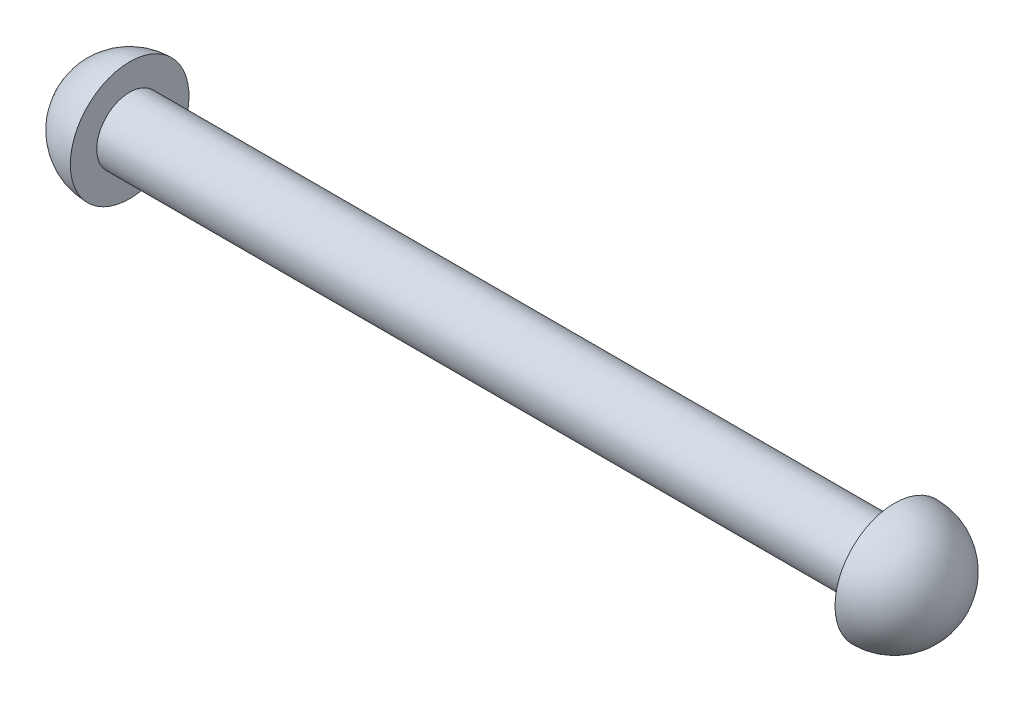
SolidWorks part; units mm, degrees
ref_plane "Front Plane" through (0, 0, 0) normal (0, 0, 1) x (1, 0, 0)
ref_plane "Top Plane" through (0, 0, 0) normal (0, 1, 0) x (1, 0, 0)
ref_plane "Right Plane" through (0, 0, 0) normal (1, 0, 0) x (0, 0, -1)
sketch "Sketch1" plane through (0, 0, 0) normal (0, 0, 1) x (1, 0, 0)
  line L0 (36.83, 0) -> (-36.83, 0)
  line L1 (-36.83, 0) -> (-36.83, 2.54)
  line L2 (-42.545, -3.175) -> (42.545, -3.175)
  line L3 (0, -3.175) -> (0, 13.5467) construction
  line L4 (36.83, 0) -> (36.83, 2.54)
  arc A0 (-36.83, 2.54) -> (-42.545, -3.175) centre (-36.83, -3.175) ccw
  arc A1 (36.83, 2.54) -> (42.545, -3.175) centre (36.83, -3.175) cw
  point P12 (0, 0)
  dimension "D1" = 5.715
  dimension "D2" = 36.83
  dimension "D3" = 3.175
revolve "Revolve1" add sketch "Sketch1" angle 360 about L2
